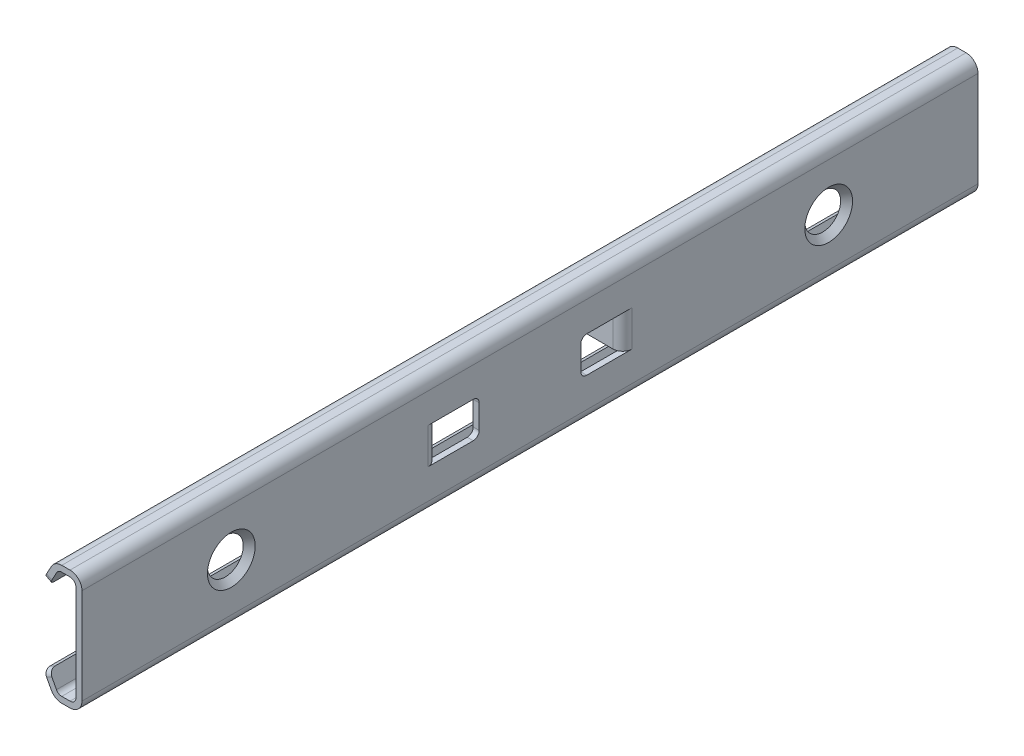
SolidWorks part; units mm, degrees
ref_plane "Front Plane" through (0, 0, 0) normal (0, 0, 1) x (1, 0, 0)
ref_plane "Top Plane" through (0, 0, 0) normal (0, 1, 0) x (1, 0, 0)
ref_plane "Right Plane" through (0, 0, 0) normal (1, 0, 0) x (0, 0, -1)
sketch "Sketch1" plane through (0, 0, 0) normal (0, 0, 1) x (1, 0, 0)
  line L0 (-4, -4.5) -> (4, -4.5) construction
  line L1 (-1, -7.5) -> (4, -7.5) construction
  line L2 (-4, -4.5) -> (-4, 4.5) construction
  line L3 (-1, 7.5) -> (4, 7.5) construction
  line L4 (4, -7.5) -> (4, 7.5) construction
  line L5 (-4, -7.5) -> (4, 7.5) construction
  line L6 (-4, 7.5) -> (4, -7.5) construction
  line L7 (3.2157, -6.0294) -> (4, -7.5) construction
  line L8 (0, 0) -> (-4, 0) construction
  line L9 (3.2157, 6.0294) -> (4, 7.5) construction
  line L10 (-3, -4.5) -> (-3, 4.5) construction
  line L11 (3, 4.6144) -> (3, 4.6144) construction
  line L12 (3, -4.6144) -> (3, 4.6144) construction
  line L13 (3, -4.6144) -> (3, -4.6144) construction
  line L14 (4, -7.5) -> (4.4196, -7.2762) construction
  line L15 (4.4196, -7.2762) -> (3, -4.6144) construction
  line L16 (4, 7.5) -> (4.4196, 7.2762) construction
  line L17 (4.4196, 7.2762) -> (3, 4.6144) construction
  line L18 (2.1127, 6.6176) -> (2.9951, 6.1471)
  line L19 (2.9951, 6.1471) -> (4.2343, 8.4706)
  line L20 (5.1167, 9) -> (6.5, 9)
  line L21 (7.5, 8) -> (7.5, 0)
  line L22 (2.1127, -6.6176) -> (2.9951, -6.1471)
  line L23 (2.9951, -6.1471) -> (4.2343, -8.4706)
  line L24 (5.1167, -9) -> (6.5, -9)
  line L25 (7.5, -8) -> (7.5, 0)
  line L27 (2.1127, 6.6176) -> (3.352, 8.9412)
  line L28 (5.1167, 10) -> (6.5, 10)
  line L29 (8.5, 8) -> (8.5, 0)
  line L30 (8.5, -8) -> (8.5, 0)
  line L31 (5.1167, -10) -> (6.5, -10)
  line L32 (2.1127, -6.6176) -> (3.352, -8.9412)
  line L34 (0, -1) -> (-4, -1)
  line L36 (6.5, 8) -> (7.5, 8) construction
  line L38 (8.5, 8) -> (7.5, 8) construction
  line L39 (6.5, 8) -> (4, 7.5) construction
  arc A0 (-1, -7.5) -> (-4, -4.5) centre (-1, -4.5) cw construction
  arc A1 (-4, 4.5) -> (-1, 7.5) centre (-1, 4.5) cw construction
  arc A2 (-1, -7.5) -> (1.451, -6.0294) centre (-1, -4.7222) ccw construction
  arc A3 (1.451, -6.0294) -> (3.2157, -6.0294) centre (2.3333, -6.5) cw construction
  arc A4 (1.451, 6.0294) -> (3.2157, 6.0294) centre (2.3333, 6.5) ccw construction
  arc A5 (-1, 7.5) -> (1.451, 6.0294) centre (-1, 4.7222) cw construction
  arc A6 (-3, 4.5) -> (-1, 6.5) centre (-1, 4.5) cw construction
  arc A7 (-1, 6.5) -> (0.5686, 5.5588) centre (-1, 4.7222) cw construction
  arc A8 (0.5686, 5.5588) -> (3, 4.6144) centre (2.3333, 6.5) ccw construction
  arc A9 (0.5686, -5.5588) -> (3, -4.6144) centre (2.3333, -6.5) cw construction
  arc A10 (-1, -6.5) -> (0.5686, -5.5588) centre (-1, -4.7222) ccw construction
  arc A11 (-1, -6.5) -> (-3, -4.5) centre (-1, -4.5) cw construction
  arc A12 (4.2343, 8.4706) -> (5.1167, 9) centre (5.1167, 8) cw
  arc A13 (6.5, 9) -> (7.5, 8) centre (6.5, 8) cw
  arc A14 (4.2343, -8.4706) -> (5.1167, -9) centre (5.1167, -8) ccw
  arc A15 (6.5, -9) -> (7.5, -8) centre (6.5, -8) ccw
  arc A16 (3.352, 8.9412) -> (5.1167, 10) centre (5.1167, 8) cw
  arc A17 (6.5, 10) -> (8.5, 8) centre (6.5, 8) cw
  arc A18 (6.5, -10) -> (8.5, -8) centre (6.5, -8) ccw
  arc A19 (3.352, -8.9412) -> (5.1167, -10) centre (5.1167, -8) ccw
  point P0 (0, 0)
  dimension "D3" = 3
  dimension "D4" = 1
  dimension "D8" = 1
  dimension "D14" = 2
  dimension "D15" = 2
  dimension "D16" = 2
  dimension "D17" = 1
  dimension "D18" = 2
  dimension "D1" = 15
  dimension "D2" = 8
  dimension "D6" = 1
  dimension "D7" = 0.25
  dimension "D10" = 12.5
  dimension "D11" = 1
  dimension "D9" = 20
  dimension "D12" = 1
  dimension "D13" = 1
  dimension "D5" = 1
extrude "Boss-Extrude1" add sketch "Sketch1" along normal mid plane 150
sketch "Sketch3" plane through (8.5, 0, 0) normal (1, 0, 0) x (0, 0, -1)
  line L0 (0, 0) -> (0, 34.5209) construction
  line L1 (-75, 0) -> (0, 0) construction
  line L2 (-75, -8) -> (-75, 8) construction
  circle A0 centre (-50, 0) radius 3
  circle A1 centre (50, 0) radius 3
  dimension "D2" = 6
  dimension "D1" = 100
extrude "Cut-Extrude2" cut sketch "Sketch3" against normal blind 250
sketch "Sketch4" plane through (8.5, 0, 0) normal (1, 0, 0) x (0, 0, -1)
  line L0 (0, 0) -> (0, 23.5846) construction
  line L1 (-16.5, -3) -> (-8.5, -3)
  line L2 (-16.5, -3) -> (-16.5, 3)
  line L3 (-16.5, 3) -> (-8.5, 3)
  line L4 (-8.5, -3) -> (-8.5, 3)
  line L5 (-16.5, -3) -> (-8.5, 3) construction
  line L6 (-16.5, 3) -> (-8.5, -3) construction
  line L7 (-12.5, 0) -> (0, 0) construction
  line L8 (16.5, 3) -> (8.5, 3)
  line L9 (8.5, -3) -> (8.5, 3)
  line L10 (16.5, -3) -> (8.5, -3)
  line L11 (16.5, -3) -> (16.5, 3)
  point P0 (-12.5, 0)
  dimension "D1" = 12.5
  dimension "D2" = 8
  dimension "D3" = 6
extrude "Cut-Extrude3" cut sketch "Sketch4" against normal blind 10
sketch "Sketch5" plane through (0, 0, 0) normal (0, 1, 0) x (1, 0, 0)
  line L0 (7.5, -16.5) -> (1.5, -16.5)
  line L1 (1.5, -16.5) -> (1.5, -15.5)
  line L2 (1.5, -15.5) -> (8.5, -15.5)
  line L3 (8.5, -15.5) -> (8.5, -16.5)
  line L4 (8.5, -16.5) -> (7.5, -16.5)
  line L5 (0, 0) -> (-10.1158, 0) construction
  line L6 (8.5, 16.5) -> (7.5, 16.5)
  line L7 (8.5, 15.5) -> (8.5, 16.5)
  line L8 (1.5, 15.5) -> (8.5, 15.5)
  line L9 (1.5, 16.5) -> (1.5, 15.5)
  line L10 (7.5, 16.5) -> (1.5, 16.5)
  dimension "D1" = 6
  dimension "D2" = 1
extrude "Boss-Extrude2" add sketch "Sketch5" along normal mid plane 6
fillet "Fillet1" radius 0.6 2 edges at (7.5, 0, -16.5) (7.5, 0, 16.5)
fillet "Fillet2" radius 1.6 2 edges at (8.5, 0, -15.5) (8.5, 0, 15.5)
chamfer "Chamfer1" distance 1 angle 45 2 edges at (8.5, -3, -50) (8.5, 3, 50)
fillet "Fillet3" radius 1 12 edges at (2.5539, -6.3824, -75) (2.5539, 6.3824, -75) (2.5539, -6.3824, 75) (2.5539, 6.3824, 75) (8, 3, 8.5) (8, -3, 8.5) (1.5, 3, 16) (1.5, -3, 16) (8, -3, -8.5) (8, 3, -8.5) (1.5, -3, -16) (1.5, 3, -16)
